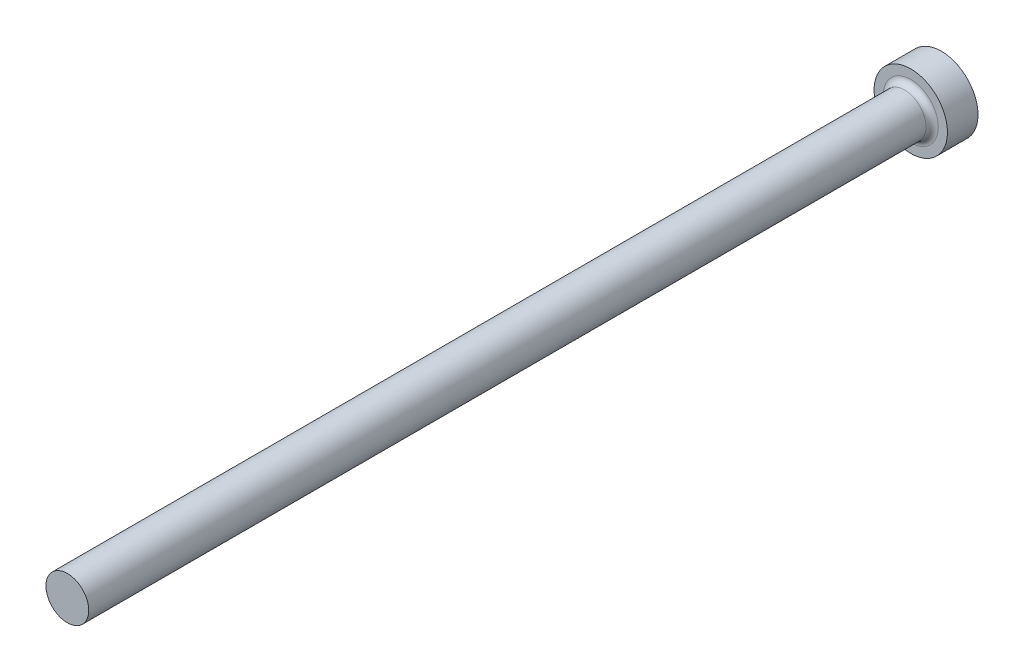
SolidWorks part; units mm, degrees
ref_plane "Plan de face" through (0, 0, 0) normal (0, 0, 1) x (1, 0, 0)
ref_plane "Plan de dessus" through (0, 0, 0) normal (0, 1, 0) x (1, 0, 0)
ref_plane "Plan de droite" through (0, 0, 0) normal (1, 0, 0) x (0, 0, -1)
imported_body "Importée1"
sketch "Esquisse1" plane through (0, 0, 0.0004) normal (0, 0, 1) x (1, 0, 0)
  circle A0 centre (0, 35.085) radius 3.5
  dimension "D1" = 7
extrude "Extrusion1" add sketch "Esquisse1" against normal up to surface (138.0004 mm away)
fillet "Congé1" radius 1 1 edges at (3.5, 35.085, -138)
